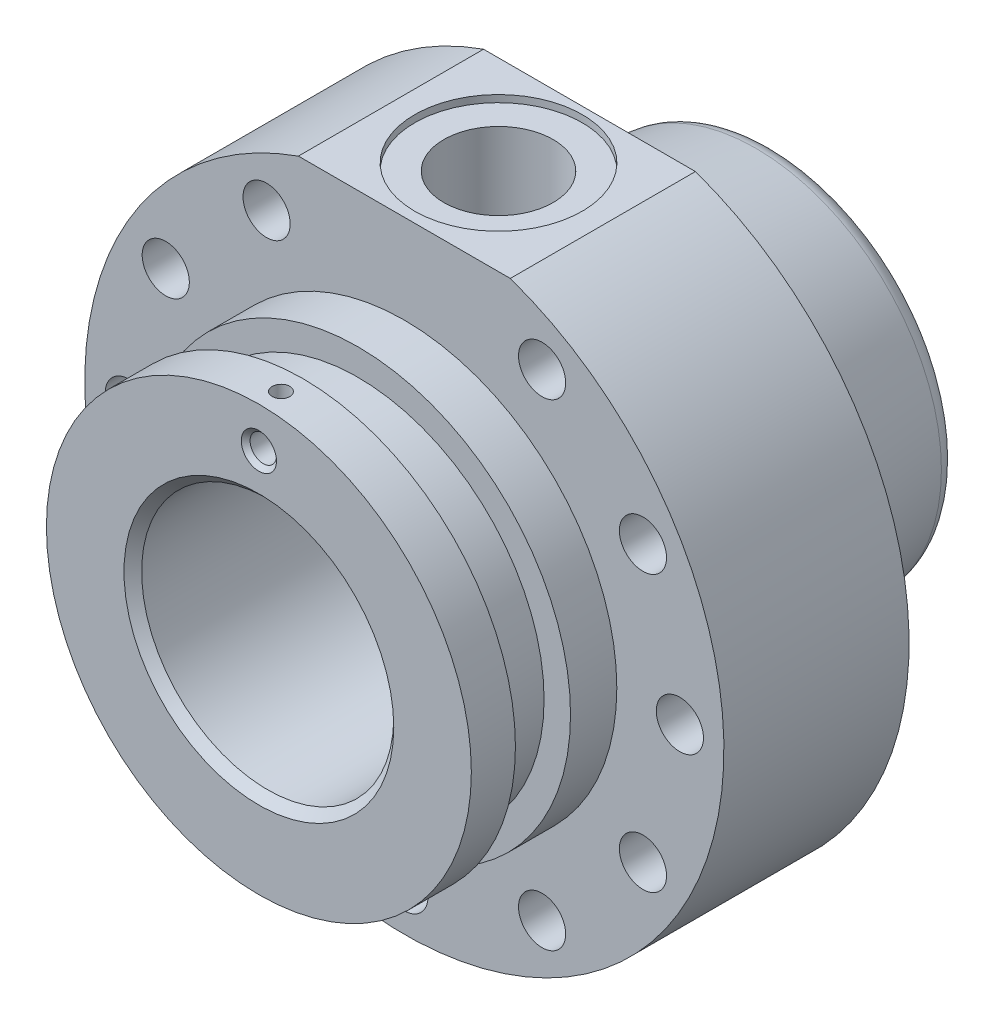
SolidWorks part; units mm, degrees
ref_plane "Front Plane" through (0, 0, 0) normal (0, 0, 1) x (1, 0, 0)
ref_plane "Top Plane" through (0, 0, 0) normal (0, 1, 0) x (1, 0, 0)
ref_plane "Right Plane" through (0, 0, 0) normal (1, 0, 0) x (0, 0, -1)
sketch "Sketch1" plane through (0, 0, 0) normal (0, 0, 1) x (1, 0, 0)
  circle A0 centre (0, 0) radius 72.5
  dimension "D1" = 145
extrude "Boss-Extrude1" add sketch "Sketch1" along normal blind 42
sketch "Sketch2" plane through (0, 0, 42) normal (0, 0, 1) x (1, 0, 0)
  circle A0 centre (0, 0) radius 48.2
  dimension "D1" = 96.4
extrude "Boss-Extrude2" add sketch "Sketch2" along normal blind 33
sketch "Sketch3" plane through (0, 0, 0) normal (1, 0, 0) x (0, 0, -1)
  line L0 (0, 28.6) -> (42, 28.6)
  line L1 (0, -72.5) -> (0, 72.5) construction
  line L2 (42, 28.6) -> (42, 41.5)
  line L3 (42, 41.5) -> (0, 47.6)
  line L4 (0, 47.6) -> (0, 28.6)
  line L5 (0, 0) -> (57.7056, 0) construction
  dimension "D1" = 47.6
  dimension "D2" = 28.6
  dimension "D3" = 42
  dimension "D4" = 41.5
revolve "Revolve1" add sketch "Sketch3" angle 360 about L5
sketch "Sketch4" plane through (0, 0, 75) normal (0, 0, 1) x (1, 0, 0)
  circle A0 centre (0, 0) radius 28.6
  dimension "D1" = 57.2
extrude "Cut-Extrude1" cut sketch "Sketch4" against normal through all
sketch "Sketch5" plane through (0, 0, -42) normal (0, 0, -1) x (-1, 0, 0)
  circle A0 centre (0, 0) radius 35
  dimension "D1" = 70
extrude "Cut-Extrude2" cut sketch "Sketch5" against normal blind 8
sketch "Sketch6" plane through (0, 0, 0) normal (1, 0, 0) x (0, 0, -1)
  line L0 (-77.0854, 0) -> (24.3024, 0) construction
  line L1 (-42, 48.2) -> (-75, 48.2) construction
  line L2 (-65, 48.2) -> (-52.5, 48.2)
  line L3 (-65, 48.2) -> (-65, 42.2)
  line L4 (-65, 42.2) -> (-52.5, 42.2)
  line L5 (-52.5, 48.2) -> (-52.5, 42.2)
  line L6 (-75, 48.2) -> (-75, -48.2) construction
  dimension "D1" = 6
  dimension "D2" = 12.5
  dimension "D3" = 10
revolve "Cut-Revolve1" cut sketch "Sketch6" angle 360 about L0
fillet "Fillet1" radius 5 1 edges at (41.5, 0, -42)
sketch "Sketch7" plane through (0, 0, 42) normal (0, 0, 1) x (1, 0, 0)
  circle A0 centre (0, 0) radius 62.5 construction
  circle A1 centre (0, 62.5) radius 5.35
  dimension "D1" = 125
  dimension "D2" = 10.7
extrude "Cut-Extrude3" cut sketch "Sketch7" against normal through all
pattern_circular "CirPattern1" count 12 over 360 about axis through (0, 0, 0) along (0, 0, 1) of "Cut-Extrude3"
chamfer "Chamfer1" distance 2 angle 45 1 edges at (28.6, 0, 75)
ref_plane "Plane1" through (0, 70, 0) normal (0, 1, 0) x (1, 0, 0)
sketch "Sketch8" plane through (0, 70, 0) normal (0, 1, 0) x (1, 0, 0)
  line L1 (-25.5, 15.6002) -> (25.5, 15.6002)
  line L2 (-25.5, 15.6002) -> (-25.5, -58.587)
  line L3 (-25.5, -58.587) -> (25.5, -58.587)
  line L4 (25.5, 15.6002) -> (25.5, -58.587)
  line L5 (-25.5, 15.6002) -> (25.5, -58.587) construction
  line L6 (-25.5, -58.587) -> (25.5, 15.6002) construction
  point P0 (0, -21.4934)
  dimension "D1" = 51
extrude "Cut-Extrude4" cut sketch "Sketch8" against normal blind 1.6 and the other way blind 23
sketch "Sketch9" plane through (0, 68.4, 0) normal (0, 1, 0) x (1, 0, 0)
  circle A0 centre (0, -20.6404) radius 19
  dimension "D1" = 38
extrude "Cut-Extrude5" cut sketch "Sketch9" against normal blind 1.6
sketch "Sketch10" plane through (0, 0, 42) normal (0, 0, 1) x (1, 0, 0)
  circle A0 centre (0, 62.5) radius 5.35 construction
  circle A1 centre (0, 62.5) radius 5.35
extrude "Boss-Extrude3" add sketch "Sketch10" against normal up to surface (42 mm away)
sketch "Sketch11" plane through (0, 66.8, 0) normal (0, 1, 0) x (1, 0, 0)
  circle A0 centre (0, -20.6404) radius 12.4
  dimension "D1" = 24.8
extrude "Cut-Extrude6" cut sketch "Sketch11" against normal blind 23 contours A0
sketch "Sketch13" plane through (0, 66.8, 0) normal (0, 1, 0) x (1, 0, 0)
  circle A0 centre (0, -20.6404) radius 19 construction
  circle A1 centre (0, -20.6404) radius 19
extrude "Cut-Extrude7" cut sketch "Sketch13" along normal blind 23
sketch "Sketch14" plane through (0, 43.8, 0) normal (0, 1, 0) x (1, 0, 0)
  circle A0 centre (0, -20.6404) radius 7.5
  dimension "D1" = 15
extrude "Cut-Extrude8" cut sketch "Sketch14" against normal blind 23
sketch "Sketch15" plane through (0, 0, 75) normal (0, 0, 1) x (1, 0, 0)
  circle A0 centre (0, 39) radius 3
  dimension "D2" = 6
  dimension "D1" = 39
extrude "Cut-Extrude9" cut sketch "Sketch15" against normal up to surface (47.4858 mm away)
chamfer "Chamfer2" distance 1 angle 45 1 edges at (3, 39, 75)
sketch "Sketch16" plane through (0, 0, 0) normal (0, 1, 0) x (1, 0, 0)
  line L0 (-48.2, -75) -> (48.2, -75) construction
  circle A0 centre (0, -70) radius 2
  dimension "D2" = 4
  dimension "D1" = 5
extrude "Cut-Extrude10" cut sketch "Sketch16" along normal through all from offset 40
